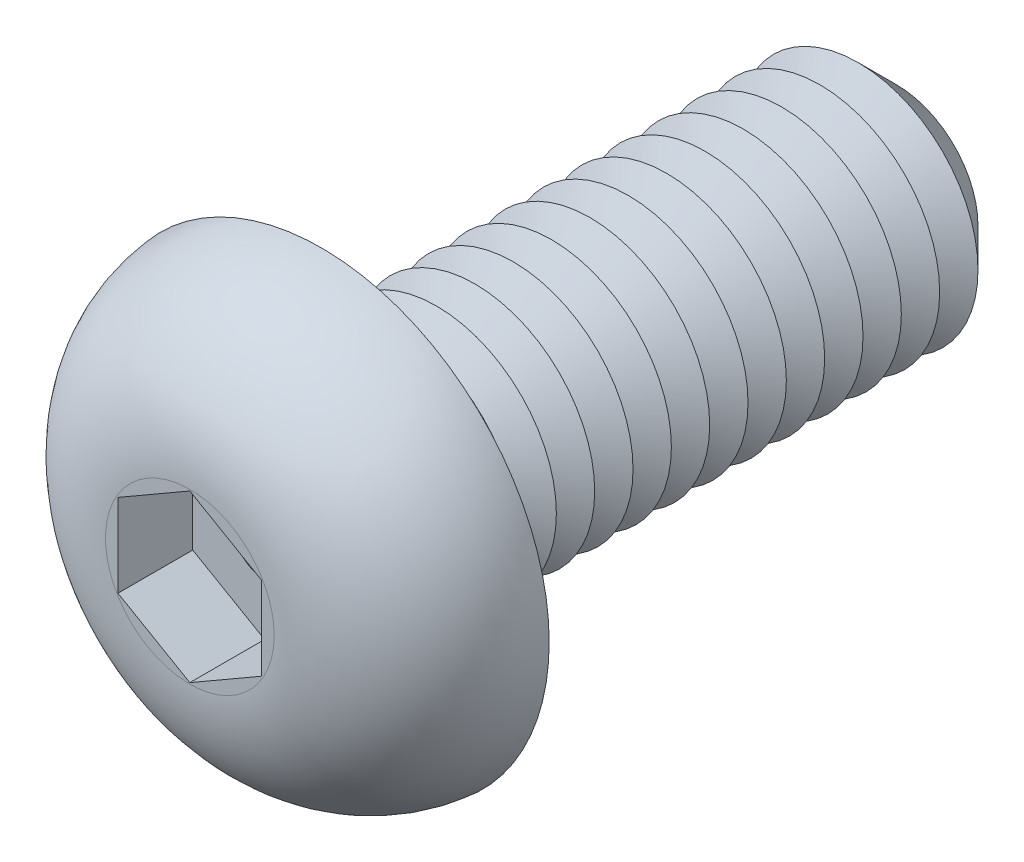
SolidWorks part; units mm, degrees
ref_plane "Front Plane" through (0, 0, 0) normal (0, 0, 1) x (1, 0, 0)
ref_plane "Top Plane" through (0, 0, 0) normal (0, 1, 0) x (1, 0, 0)
ref_plane "Right Plane" through (0, 0, 0) normal (1, 0, 0) x (0, 0, -1)
sketch "Sketch1" plane through (0, 0, 0) normal (1, 0, 0) x (0, 0, -1)
  line L0 (-47.9342, 0) -> (60.3146, 0) construction
sketch "Sketch2" plane through (0, 0, 0) normal (1, 0, 0) x (0, 0, -1)
  line L0 (0, 0) -> (-2.75, 0)
  line L1 (-47.9342, 0) -> (60.3146, 0) construction
  line L2 (-2.75, 0) -> (-2.75, 1.7604)
  line L3 (0, 4.75) -> (0, 0)
  arc A0 (-2.75, 1.7604) -> (0, 4.75) centre (0.25, 1.7604) cw
  dimension "D1" = 3
  dimension "D2" = 2.75
  dimension "D3" = 4.75
revolve "Revolve1" add sketch "Sketch2" angle 360 about L0
sketch "Sketch3" plane through (0, 0, 2.75) normal (0, 0, 1) x (1, 0, 0)
  line L1 (0, 1.7321) -> (-1.5, 0.866)
  line L2 (-1.5, 0.866) -> (-1.5, -0.866)
  line L3 (-1.5, -0.866) -> (0, -1.7321)
  line L4 (0, -1.7321) -> (1.5, -0.866)
  line L5 (1.5, -0.866) -> (1.5, 0.866)
  line L6 (1.5, 0.866) -> (0, 1.7321)
  circle A0 centre (0, 0) radius 1.5 construction
  dimension "D1" = 3
extrude "Cut-Extrude1" cut sketch "Sketch3" against normal blind 1.56
sketch "Sketch4" plane through (0, 0, 0) normal (0, 0, -1) x (-1, 0, 0)
  circle A0 centre (0, 0) radius 2.5
  dimension "D1" = 5
extrude "Boss-Extrude1" add sketch "Sketch4" along normal blind 12
chamfer "Chamfer1" distance 0.8 angle 45 1 edges at (-2.5, 0, -12)
sketch "Sketch5" plane through (0, 0, 0) normal (1, 0, 0) x (0, 0, -1)
  line L0 (0.8, 2.5) -> (1.6, 2.5)
  line L1 (11.2, 2.5) -> (0, 2.5) construction
  line L2 (1.6, 2.5) -> (1.2, 1.8072)
  line L3 (1.2, 1.8072) -> (0.8, 2.5)
  line L4 (0, -4.75) -> (0, 4.75) construction
  line L5 (11.2, 2.5) -> (0, 2.5) construction
  dimension "D1" = 0.8
  dimension "D2" = 0.8
revolve "Cut-Revolve1" cut sketch "Sketch5" angle 360 about L0
pattern_linear "LPattern1" count 13 spacing 0.8 along (0, 0, -1) of "Cut-Revolve1"
fillet "Fillet2" radius 0.4 1 edges at (2.5, 0, 0)
sketch "Sketch6" plane through (0, 0, 1.19) normal (0, 0, 1) x (1, 0, 0)
  circle A0 centre (0, 0) radius 0.65
  dimension "D1" = 1.3
extrude "Cut-Extrude2" cut sketch "Sketch6" against normal up to surface (13.19 mm away)
